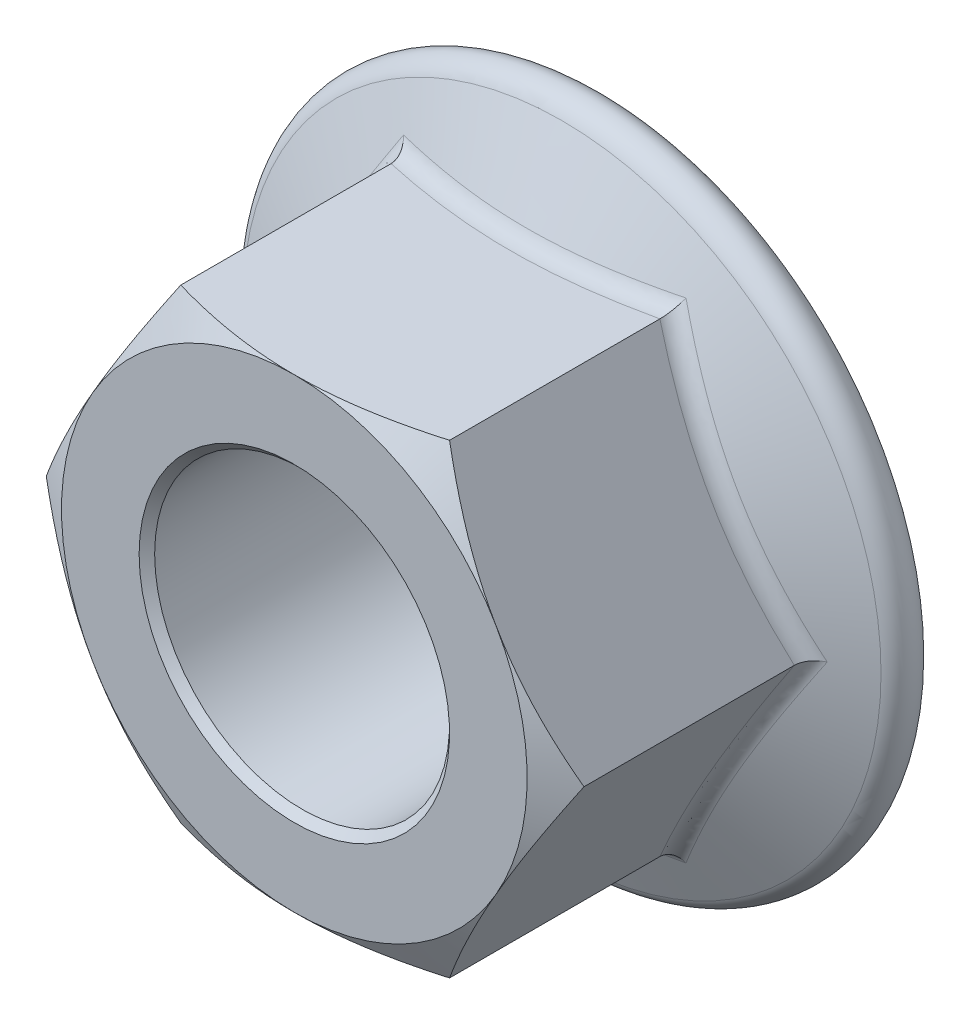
SolidWorks part; units mm, degrees
ref_plane "Front" through (0, 0, 0) normal (0, 0, 1) x (1, 0, 0)
ref_plane "Top" through (0, 0, 0) normal (0, 1, 0) x (1, 0, 0)
ref_plane "Right" through (0, 0, 0) normal (1, 0, 0) x (0, 0, -1)
sketch "Sketch1" plane through (0, 0, 0) normal (0, 0, 1) x (1, 0, 0)
  line L1 (8.6603, -15) -> (17.3205, 0)
  line L2 (17.3205, 0) -> (8.6603, 15)
  line L3 (8.6603, 15) -> (-8.6603, 15)
  line L4 (-8.6603, 15) -> (-17.3205, 0)
  line L5 (-17.3205, 0) -> (-8.6603, -15)
  line L6 (-8.6603, -15) -> (8.6603, -15)
  circle A0 centre (0, 0) radius 15 construction
  circle A1 centre (0, 0) radius 9.5
  dimension "D1" = 19
  dimension "s" = 30
extrude "BaseNut" add sketch "Sketch1" against normal blind 20
sketch "Sketch3" plane through (0.6779, 0, -16.6426) normal (0, 1, 0) x (0, 0, -1)
  line L0 (4.0352, 0.6779) -> (-19.0613, 0.6779) construction
  line L2 (-16.6426, 15.6779) -> (-15.3029, 17.9984)
  line L4 (-15.3029, 17.9984) -> (-16.6426, 17.9984)
  line L5 (-16.6426, 17.9984) -> (-16.6426, 15.6779)
  line L6 (-6.6426, 17.9984) -> (-6.6426, 14.238) construction
  line L8 (3.3574, 17.9984) -> (3.3574, 15.6779)
  line L9 (2.0176, 17.9984) -> (3.3574, 17.9984)
  line L10 (3.3574, 15.6779) -> (2.0176, 17.9984)
  line L11 (3.3574, 17.9984) -> (-16.6426, 17.9984) construction
  dimension "D1" = 30
  dimension "sq" = 30
revolve "Double-Chamfer" cut sketch "Sketch3" angle 360 about L0
sketch "Sketch4" plane through (4.6827, 0, -16.7173) normal (0, 1, 0) x (0, 0, -1)
  line L0 (-21.7744, 4.6827) -> (9.7398, 4.6827) construction
  line L1 (-4.6401, 31.5206) -> (-4.6401, 11.2522) construction
  line L2 (3.2827, 14.1827) -> (3.2827, 24.6327)
  line L3 (0.5185, 25.2455) -> (-4.6401, 14.1827)
  line L4 (3.2827, 14.1827) -> (-16.7173, 14.1827) construction
  line L11 (-4.6401, 14.1827) -> (3.2827, 14.1827)
  arc A0 (3.2827, 24.6327) -> (0.5185, 25.2455) centre (1.8327, 24.6327) ccw
  dimension "m1" = 20
  dimension "dc" = 42.8
  dimension "dw" = 39.9
  dimension "&" = 25
revolve "Flange" add sketch "Sketch4" angle 360 about L0
fillet "FlangeFillet" radius 1.2 6 edges at (15.0051, -4.0104, -14.8899) (-10.9757, -10.9896, -14.8899) (10.9757, 10.9896, -14.8899) (-15.0051, 4.0104, -14.8899)
sketch "Sketch5" plane through (-5.1971, 0, -15.1971) normal (0, 1, 0) x (0, 0, -1)
  line L0 (3.5984, -5.1971) -> (-23.9926, -5.1971) construction
  line L2 (-15.1971, 4.8029) -> (-15.1971, 4.3029)
  line L4 (-15.1971, 4.3029) -> (-14.6971, 4.3029)
  line L6 (-14.6971, 4.3029) -> (-15.1971, 4.8029)
  line L7 (-5.1971, 4.3029) -> (-5.1971, 0.8242) construction
  line L8 (4.3029, 4.3029) -> (4.8029, 4.8029)
  line L9 (4.8029, 4.3029) -> (4.3029, 4.3029)
  line L10 (4.8029, 4.8029) -> (4.8029, 4.3029)
  line L15 (4.8029, 4.3029) -> (-15.1971, 4.3029) construction
  dimension "da" = 20
  dimension "D2" = 45
revolve "Hole" cut sketch "Sketch5" angle 360 about L0
sketch "Sketch6" plane through (0, 0, 0) normal (0, 1, 0) x (1, 0, 0)
  line L0 (-9.933, 0.5) -> (-9.5, 0.25)
  line L1 (-9.5, 0.25) -> (-9, 0.25)
  line L2 (-9, 0.25) -> (-9, 0.75)
  line L3 (-9, 0.75) -> (-9.5, 0.75)
  line L4 (-9.5, 0.75) -> (-9.933, 0.5)
  line L5 (0, 5.2426) -> (0, 47.481) construction
  dimension "D1" = 0.5
  dimension "D2" = 19
revolve "Cut-Revolve10" [suppressed] cut sketch "Sketch6" angle 360 about L5
pattern_linear "LPattern10" [suppressed] count 31 spacing 0.6 along (0, 0, -1)
equation "\"m1@Sketch4\" = \"m@BaseNut\""
equation "\"sq@Sketch3\" = \"s@Sketch1\""
equation "\"D2@Sketch6\"=\"D1@Sketch1\""
equation "\"D1@Sketch6\"= ( \"D2@ThreadCosmetic1\" - \"D2@Sketch6\" )  / 2"
equation "\"D3@LPattern10\" = \"D1@Sketch6\" * 1.2"
equation "\"D1@LPattern10\" = \"m@BaseNut\" / \"D3@LPattern10\"-2"
